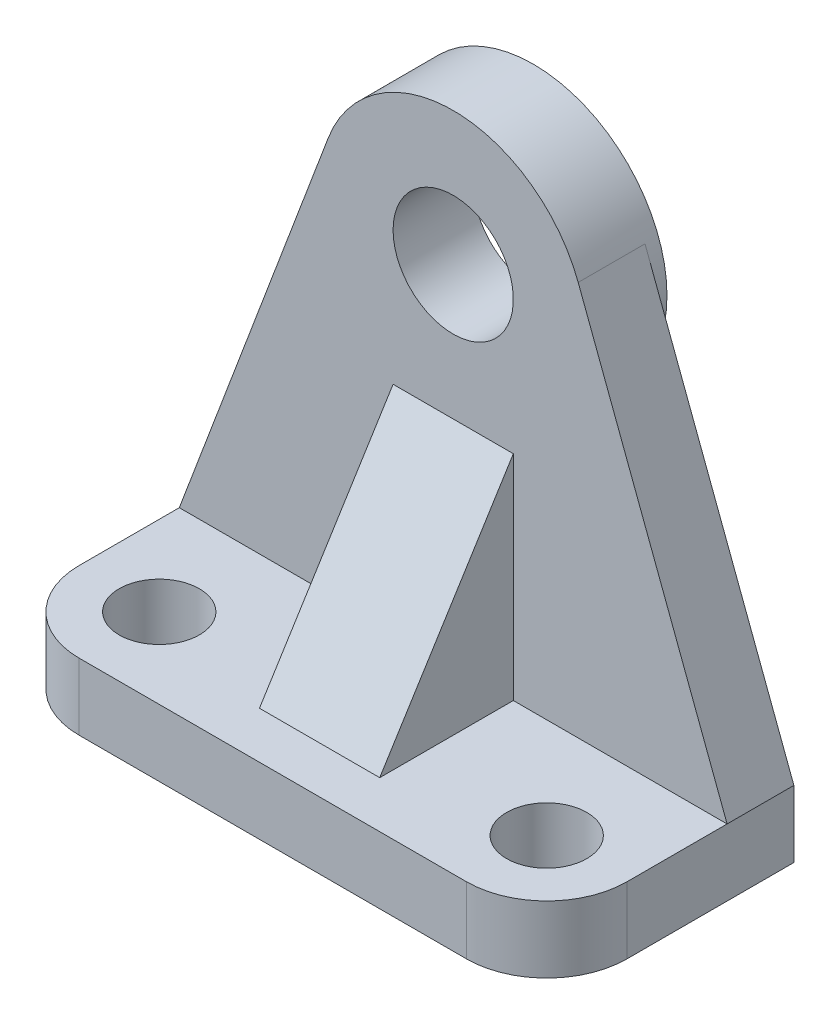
SolidWorks part; units mm, degrees
ref_plane "Front Plane" through (0, 0, 0) normal (0, 0, 1) x (1, 0, 0)
ref_plane "Top Plane" through (0, 0, 0) normal (0, 1, 0) x (1, 0, 0)
ref_plane "Right Plane" through (0, 0, 0) normal (1, 0, 0) x (0, 0, -1)
sketch "Sketch1" plane through (0, 0, 0) normal (0, 1, 0) x (1, 0, 0)
  line L1 (-41, 18.5) -> (41, 18.5)
  line L2 (-41, 18.5) -> (-41, -6.5)
  line L3 (-29, -18.5) -> (29, -18.5)
  line L4 (41, 18.5) -> (41, -6.5)
  line L5 (-41, 18.5) -> (41, -18.5) construction
  line L6 (-41, -18.5) -> (41, 18.5) construction
  circle A0 centre (-29, -6.5) radius 6
  circle A1 centre (29, -6.5) radius 6
  arc A2 (29, -18.5) -> (41, -6.5) centre (29, -6.5) ccw
  arc A3 (-41, -6.5) -> (-29, -18.5) centre (-29, -6.5) ccw
  point P0 (0, 0)
  dimension "D5" = 12
  dimension "D7" = 12
  dimension "D1" = 37
  dimension "D2" = 82
  dimension "D3" = 12
  dimension "D4" = 12
  dimension "D6" = 58
extrude "Boss-Extrude1" add sketch "Sketch1" along normal blind 10
sketch "Sketch2" plane through (0, 0, -18.5) normal (0, 0, -1) x (-1, 0, 0)
  line L0 (-18.712, 69.0614) -> (-41, 10)
  line L1 (-41, 10) -> (41, 10)
  line L2 (41, 10) -> (18.712, 69.0614)
  arc A0 (18.712, 69.0614) -> (-18.712, 69.0614) centre (0, 62) ccw
  dimension "D2" = 40
  dimension "D1" = 62
extrude "Boss-Extrude2" add sketch "Sketch2" against normal blind 10
sketch "Sketch3" plane through (0, 0, -18.5) normal (0, 0, -1) x (-1, 0, 0)
  circle A0 centre (0, 62) radius 20
  arc A1 (18.712, 69.0614) -> (-18.712, 69.0614) centre (0, 62) ccw construction
extrude "Boss-Extrude3" add sketch "Sketch3" along normal blind 2
sketch "Sketch4" plane through (0, 0, -20.5) normal (0, 0, -1) x (-1, 0, 0)
  circle A0 centre (0, 62) radius 9
  arc A1 (-18.712, 69.0614) -> (18.712, 69.0614) centre (0, 62) ccw construction
  dimension "D1" = 18
extrude "Cut-Extrude1" cut sketch "Sketch4" against normal through all
sketch "Sketch5" plane through (0, 0, 0) normal (1, 0, 0) x (0, 0, -1)
  line L0 (-11.5, 10) -> (8.5, 42)
  line L1 (-6.5, 10) -> (-18.5, 10) construction
  line L2 (8.5, 69.0614) -> (8.5, 10) construction
  line L3 (-6.5, 10) -> (8.5, 10) construction
  dimension "D1" = 32
  dimension "D2" = 20
rib "Rib1" sketch "Sketch5" sketch "Sketch5" thickness 18 extrusion direction parallel to sketch draft on no parameters "D1"=18
